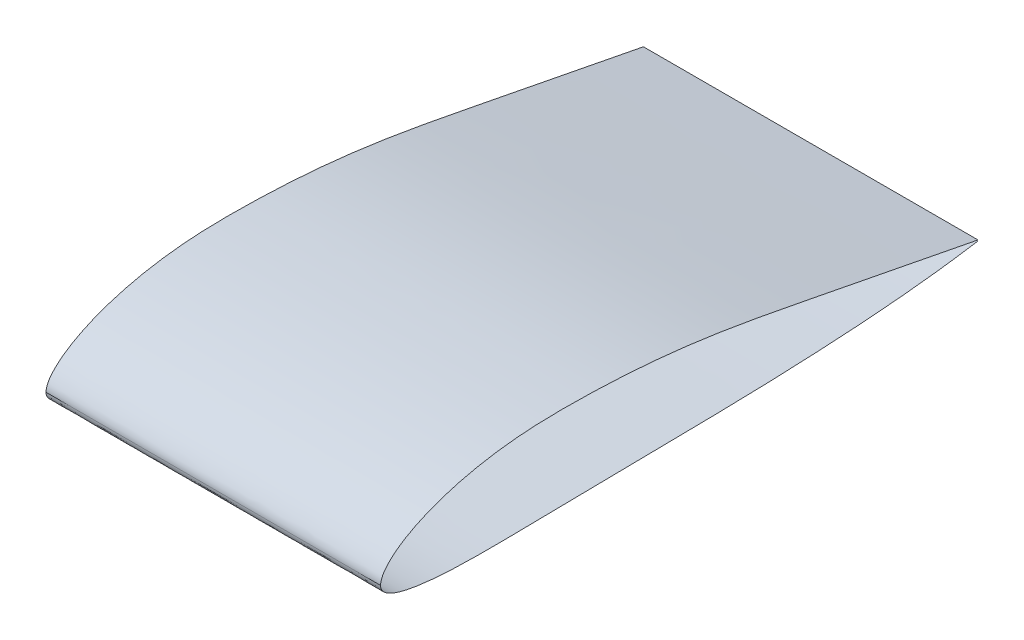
SolidWorks part; units mm, degrees
ref_plane "Спереди" through (0, 0, 0) normal (0, 0, 1) x (1, 0, 0)
ref_plane "Сверху" through (0, 0, 0) normal (0, 1, 0) x (1, 0, 0)
ref_plane "Справа" through (0, 0, 0) normal (1, 0, 0) x (0, 0, -1)
sketch "Эскиз1" plane through (0, 0, 0) normal (1, 0, 0) x (0, 0, -1)
  line L0 (0, 0) -> (100, 0) construction
  line L1 (0.25, 0.99) -> (0.25, 0) construction
  line L2 (0.75, 1.85) -> (0.75, 0) construction
  line L3 (0.5, 1.47) -> (0.5, 0) construction
  line L4 (1, 2.14) -> (1, 0) construction
  line L5 (1.25, 2.44) -> (1.25, 0) construction
  line L6 (1.75, 2.97) -> (1.75, 0) construction
  line L7 (2.5, 3.61) -> (2.5, 0) construction
  line L8 (3.25, 4.2) -> (3.25, 0) construction
  line L9 (5, 5.34) -> (5, 0) construction
  line L10 (7.5, 6.55) -> (7.5, 0) construction
  line L11 (10, 7.49) -> (10, 0) construction
  line L12 (15, 8.83) -> (15, 0) construction
  line L13 (20, 9.72) -> (20, 0) construction
  line L14 (30, 10.33) -> (30, 0) construction
  line L15 (40, 10.09) -> (40, 0) construction
  line L16 (50, 9.25) -> (50, 0) construction
  line L17 (60, 7.85) -> (60, 0) construction
  line L18 (70, 5.92) -> (70, 0) construction
  line L19 (80, 3.94) -> (80, 0) construction
  line L20 (85, 2.97) -> (85, 0) construction
  line L21 (90, 2.01) -> (90, 0) construction
  line L22 (95, 1.05) -> (95, 0) construction
  line L23 (100, 0.08) -> (100, 0)
  line L24 (100, 0) -> (100, -0.08)
  line L25 (0.25, 0) -> (0.25, -0.83) construction
  line L26 (0.5, 0) -> (0.5, -1.19) construction
  line L27 (0.75, 0) -> (0.75, -1.44) construction
  line L28 (1, 0) -> (1, -1.63) construction
  line L29 (1.25, 0) -> (1.25, -1.76) construction
  line L30 (1.75, 0) -> (1.75, -2.04) construction
  line L31 (2.5, 0) -> (2.5, -2.32) construction
  line L32 (3.25, 0) -> (3.25, -2.56) construction
  line L33 (5, 0) -> (5, -2.93) construction
  line L34 (7.5, 0) -> (7.5, -3.28) construction
  line L35 (10, 0) -> (10, -3.53) construction
  line L36 (15, 0) -> (15, -3.78) construction
  line L37 (20, -3.78) -> (20, 0) construction
  line L38 (30, -3.67) -> (30, 0) construction
  line L39 (40, -3.49) -> (40, 0) construction
  line L40 (50, -3.32) -> (50, 0) construction
  line L41 (60, -3.14) -> (60, 0) construction
  line L42 (70, -2.83) -> (70, 0) construction
  line L43 (80, -2.31) -> (80, 0) construction
  line L44 (85, -1.89) -> (85, 0) construction
  line L45 (90, -1.47) -> (90, 0) construction
  line L46 (95, -0.8) -> (95, 0) construction
  spline S0 degree 3 poles (0, 0) (0.0598, 0.3387) (0.1514, 0.857) (0.4827, 1.447) (0.7239, 1.8398) (1.0061, 2.1384) (1.3169, 2.5308) (1.7998, 3.0428) (2.4914, 3.6042) (3.5384, 4.4449) (5.1746, 5.5002) (7.4537, 6.5698) (10.7723, 7.8153) (14.9564, 8.881) (21.6115, 10.0943) (29.9995, 10.4408) (40.0153, 10.19) (50.0301, 9.3333) (60.0482, 7.956) (70.0009, 5.9051) (78.3304, 4.2622) (84.999, 2.9682) (90, 2.0099) (95.0011, 1.0523) (98.3335, 0.4041) (100, 0.08) knots 0 0 0 0 0.009804 0.015 0.019367 0.023043 0.026793 0.033788 0.043255 0.052417 0.07247 0.099136 0.12478 0.17448 0.223241 0.319432 0.415472 0.511822 0.608771 0.706555 0.804432 0.853333 0.902216 0.951099 1 1 1 1
  spline S1 degree 3 poles (0, 0) (0.0584, -0.2875) (0.1464, -0.7204) (0.4735, -1.1768) (0.7361, -1.4349) (0.9842, -1.6356) (1.3415, -1.7951) (1.8032, -2.1037) (2.4986, -2.3143) (3.5617, -2.6802) (5.2421, -2.9842) (7.4935, -3.2955) (10.8265, -3.6262) (14.9974, -3.8286) (21.6672, -3.763) (30.0005, -3.6897) (39.9999, -3.4834) (49.9999, -3.3168) (60.002, -3.1693) (70.0026, -2.8457) (78.3443, -2.4967) (84.9976, -1.8654) (90.0163, -1.5382) (95.0021, -0.7945) (98.3333, -0.3183) (100, -0.08) knots 0 0 0 0 0.008548 0.012871 0.016357 0.019454 0.022233 0.027884 0.035779 0.043545 0.061184 0.086079 0.110856 0.160226 0.209535 0.308158 0.406791 0.505422 0.604055 0.702719 0.801469 0.850952 0.900434 0.950183 1 1 1 1
  dimension "D1" = 100
  dimension "D2" = 0.25
  dimension "D3" = 0.5
  dimension "D4" = 0.75
  dimension "D5" = 1
  dimension "D6" = 1.25
  dimension "D7" = 1.75
  dimension "D8" = 2.5
  dimension "D9" = 3.25
  dimension "D10" = 5
  dimension "D11" = 7.5
  dimension "D12" = 10
  dimension "D13" = 15
  dimension "D14" = 20
  dimension "D15" = 30
  dimension "D16" = 40
  dimension "D17" = 50
  dimension "D18" = 95
  dimension "D19" = 90
  dimension "D20" = 85
  dimension "D21" = 80
  dimension "D22" = 70
  dimension "D23" = 60
  dimension "D24" = 0.99
  dimension "D25" = 1.47
  dimension "D26" = 1.85
  dimension "D27" = 2.14
  dimension "D28" = 2.44
  dimension "D29" = 2.97
  dimension "D30" = 3.61
  dimension "D31" = 4.2
  dimension "D32" = 5.34
  dimension "D33" = 6.55
  dimension "D34" = 7.49
  dimension "D35" = 8.83
  dimension "D36" = 9.72
  dimension "D37" = 10.33
  dimension "D38" = 10.09
  dimension "D39" = 9.25
  dimension "D40" = 7.85
  dimension "D41" = 5.92
  dimension "D42" = 3.94
  dimension "D43" = 2.97
  dimension "D44" = 1.05
  dimension "D45" = 0.08
  dimension "D46" = 2.01
  dimension "D47" = 0.08
  dimension "D48" = 0.8
  dimension "D49" = 1.47
  dimension "D50" = 1.89
  dimension "D51" = 2.31
  dimension "D52" = 2.83
  dimension "D53" = 3.14
  dimension "D54" = 3.32
  dimension "D55" = 3.49
  dimension "D56" = 3.67
  dimension "D57" = 3.78
  dimension "D58" = 3.78
  dimension "D59" = 3.53
  dimension "D60" = 3.28
  dimension "D61" = 2.93
  dimension "D62" = 2.56
  dimension "D63" = 2.32
  dimension "D64" = 2.04
  dimension "D65" = 1.76
  dimension "D66" = 1.63
  dimension "D67" = 1.44
  dimension "D68" = 1.19
  dimension "D69" = 0.83
sketch "Sketch2" plane through (0, 0, 0) normal (1, 0, 0) x (0, 0, -1)
  line L0 (0, 3.4255) -> (0, -3.4327) construction
  line L1 (0, -1.8184) -> (0, 4.1869) construction
  spline S0 degree 3 poles (0, 0) (0, 0.2051) (0.5747, 3.9364) (12.323, 10.3898) (46.7827, 10.341) (68.065, 6.3498) (88.1041, 2.3643) (100, 0.08) knots 0 0 0 0 0.019121 0.344181 0.417524 0.733424 1 1 1 1
  spline S1 degree 3 poles (0, 0) (0, -0.201) (0.5519, -3.4686) (15.6465, -3.8929) (31.6846, -3.541) (58.0816, -3.3792) (79.8794, -2.3833) (90.4885, -1.6007) (100, -0.08) knots 0 0 0 0 0.010163 0.18294 0.247997 0.605848 0.685521 1 1 1 1
surface "Surface-Extrude1" sketch "Sketch2" parameters "D1"=56
surface "Surface-Extrude2" [suppressed] sketch "Эскиз1" parameters "D1"=56
equation "\"D2@Эскиз1\" = \"D1@Эскиз1\"/100*0.25"
equation "\"D3@Эскиз1\" = \"D1@Эскиз1\"/100*0.50"
equation "\"D4@Эскиз1\" = \"D1@Эскиз1\"/100*0.75"
equation "\"D5@Эскиз1\" = \"D1@Эскиз1\"/100*1"
equation "\"D6@Эскиз1\" = \"D1@Эскиз1\"/100*1.25"
equation "\"D7@Эскиз1\" = \"D1@Эскиз1\"/100*1.75"
equation "\"D8@Эскиз1\" = \"D1@Эскиз1\"/100*2.5"
equation "\"D9@Эскиз1\" = \"D1@Эскиз1\"/100*3.25"
equation "\"D10@Эскиз1\" = \"D1@Эскиз1\"/100*5"
equation "\"D11@Эскиз1\" = \"D1@Эскиз1\"/100*7.5"
equation "\"D12@Эскиз1\" = \"D1@Эскиз1\"/100*10"
equation "\"D13@Эскиз1\" = \"D1@Эскиз1\"/100*15"
equation "\"D14@Эскиз1\" = \"D1@Эскиз1\"/100*20"
equation "\"D15@Эскиз1\" = \"D1@Эскиз1\"/100*30"
equation "\"D16@Эскиз1\" = \"D1@Эскиз1\"/100*40"
equation "\"D17@Эскиз1\" = \"D1@Эскиз1\"/100*50"
equation "\"D23@Эскиз1\" = \"D1@Эскиз1\"/100*60"
equation "\"D22@Эскиз1\" = \"D1@Эскиз1\"/100*70"
equation "\"D21@Эскиз1\" = \"D1@Эскиз1\"/100*80"
equation "\"D20@Эскиз1\" = \"D1@Эскиз1\"/100*85"
equation "\"D19@Эскиз1\" = \"D1@Эскиз1\"/100*90"
equation "\"D18@Эскиз1\" = \"D1@Эскиз1\"/100*95"
equation "\"D24@Эскиз1\" = \"D1@Эскиз1\"/100*0.99"
equation "\"D25@Эскиз1\" = \"D1@Эскиз1\"/100*1.47"
equation "\"D26@Эскиз1\" = \"D1@Эскиз1\"/100*1.85"
equation "\"D27@Эскиз1\" = \"D1@Эскиз1\"/100*2.14"
equation "\"D28@Эскиз1\" = \"D1@Эскиз1\"/100*2.44"
equation "\"D29@Эскиз1\" = \"D1@Эскиз1\"/100*2.97"
equation "\"D30@Эскиз1\" = \"D1@Эскиз1\"/100*3.61"
equation "\"D31@Эскиз1\" = \"D1@Эскиз1\"/100*4.20"
equation "\"D32@Эскиз1\" = \"D1@Эскиз1\"/100*5.34"
equation "\"D33@Эскиз1\" = \"D1@Эскиз1\"/100*6.55"
equation "\"D34@Эскиз1\" = \"D1@Эскиз1\"/100*7.49"
equation "\"D35@Эскиз1\" = \"D1@Эскиз1\"/100*8.83"
equation "\"D36@Эскиз1\" = \"D1@Эскиз1\"/100*9.72"
equation "\"D37@Эскиз1\" = \"D1@Эскиз1\"/100*10.33"
equation "\"D38@Эскиз1\" = \"D1@Эскиз1\"/100*10.09"
equation "\"D39@Эскиз1\" = \"D1@Эскиз1\"/100*9.25"
equation "\"D40@Эскиз1\" = \"D1@Эскиз1\"/100*7.85"
equation "\"D41@Эскиз1\" = \"D1@Эскиз1\"/100*5.92"
equation "\"D42@Эскиз1\" = \"D1@Эскиз1\"/100*3.94"
equation "\"D43@Эскиз1\" = \"D1@Эскиз1\"/100*2.97"
equation "\"D46@Эскиз1\" = \"D1@Эскиз1\"/100*2.01"
equation "\"D44@Эскиз1\" = \"D1@Эскиз1\"/100*1.05"
equation "\"D45@Эскиз1\" = \"D1@Эскиз1\"/100*0.08"
equation "\"D69@Эскиз1\" = \"D1@Эскиз1\"/100*0.83"
equation "\"D68@Эскиз1\" = \"D1@Эскиз1\"/100*1.19"
equation "\"D67@Эскиз1\" = \"D1@Эскиз1\"/100*1.44"
equation "\"D66@Эскиз1\" = \"D1@Эскиз1\"/100*1.63"
equation "\"D65@Эскиз1\" = \"D1@Эскиз1\"/100*1.76"
equation "\"D64@Эскиз1\" = \"D1@Эскиз1\"/100*2.04"
equation "\"D63@Эскиз1\" = \"D1@Эскиз1\"/100*2.32"
equation "\"D62@Эскиз1\" = \"D1@Эскиз1\"/100*2.56"
equation "\"D61@Эскиз1\" = \"D1@Эскиз1\"/100*2.93"
equation "\"D60@Эскиз1\" = \"D1@Эскиз1\"/100*3.28"
equation "\"D59@Эскиз1\" = \"D1@Эскиз1\"/100*3.53"
equation "\"D58@Эскиз1\" = \"D1@Эскиз1\"/100*3.78"
equation "\"D57@Эскиз1\" = \"D1@Эскиз1\"/100*3.78"
equation "\"D56@Эскиз1\" = \"D1@Эскиз1\"/100*3.67"
equation "\"D55@Эскиз1\" = \"D1@Эскиз1\"/100*3.49"
equation "\"D54@Эскиз1\" = \"D1@Эскиз1\"/100*3.32"
equation "\"D53@Эскиз1\" = \"D1@Эскиз1\"/100*3.14"
equation "\"D52@Эскиз1\" = \"D1@Эскиз1\"/100*2.83"
equation "\"D51@Эскиз1\" = \"D1@Эскиз1\"/100*2.31"
equation "\"D50@Эскиз1\" = \"D1@Эскиз1\"/100*1.89"
equation "\"D49@Эскиз1\" = \"D1@Эскиз1\"/100*1.47"
equation "\"D48@Эскиз1\" = \"D1@Эскиз1\"/100*0.8"
equation "\"D47@Эскиз1\" = \"D1@Эскиз1\"/100*0.08"
